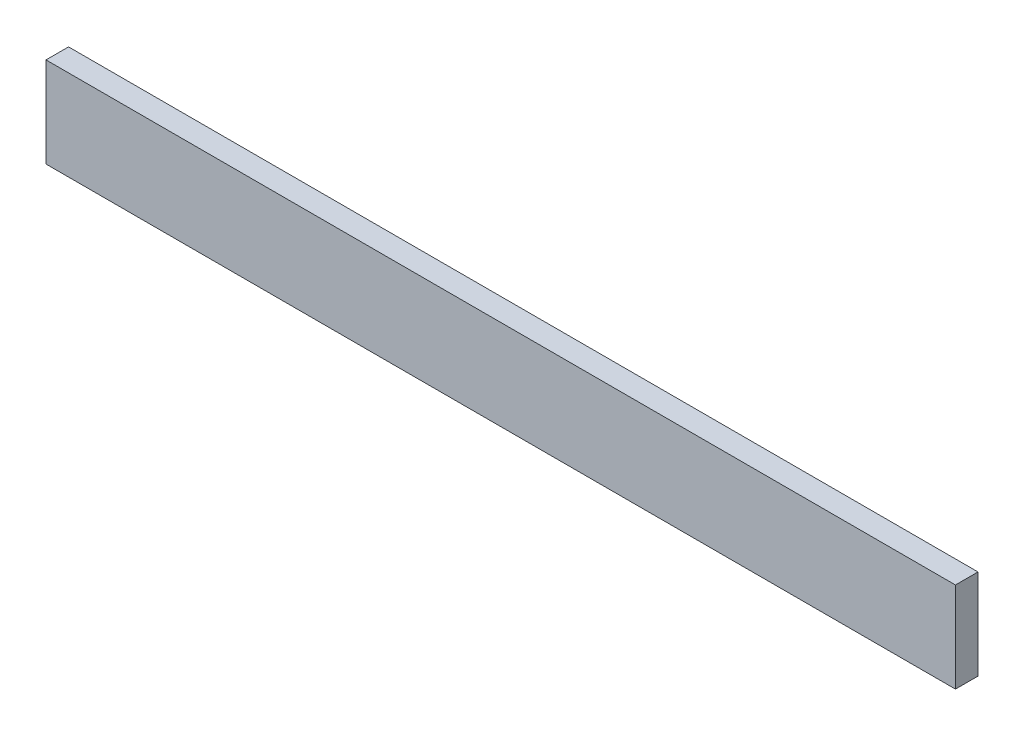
SolidWorks part; units mm, degrees
ref_plane "Front Plane" through (0, 0, 0) normal (0, 0, 1) x (1, 0, 0)
ref_plane "Top Plane" through (0, 0, 0) normal (0, 1, 0) x (1, 0, 0)
ref_plane "Right Plane" through (0, 0, 0) normal (1, 0, 0) x (0, 0, -1)
sketch "Sketch1" plane through (0, 0, 0) normal (0, 0, 1) x (1, 0, 0)
  line L1 (-252, -25) -> (252, -25)
  line L2 (-252, -25) -> (-252, 25)
  line L3 (-252, 25) -> (252, 25)
  line L4 (252, -25) -> (252, 25)
  line L5 (-252, -25) -> (252, 25) construction
  line L6 (-252, 25) -> (252, -25) construction
  point P0 (0, 0)
  dimension "D1" = 50
  dimension "D2" = 504
extrude "Boss-Extrude1" add sketch "Sketch1" along normal blind 12.5
